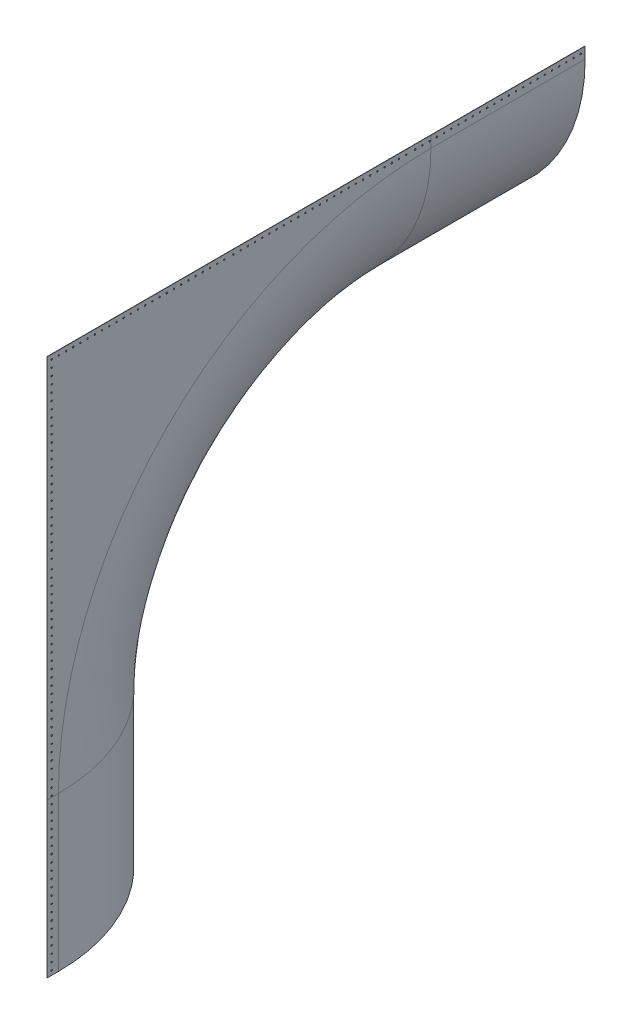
SolidWorks part; units mm, degrees
ref_plane "Front Plane" through (0, 0, 0) normal (1, 0, 0) x (0, 1, 0)
ref_plane "Top Plane" through (0, 0, 0) normal (0, 0, 1) x (0, 1, 0)
ref_plane "Right Plane" through (0, 0, 0) normal (0, 1, 0) x (-1, 0, 0)
sketch "sk 48.2in rad pnl" plane through (0, 0, 0) normal (0, 0, 1) x (0, 1, 0)
  line B0 (0, -1222.6925) -> (75.7466, -1222.6925)
  line B1 (-1222.6925, 75.7378) -> (-1222.6925, 0)
  line B2 (-1224.28, 75.7378) -> (-1224.28, 0)
  line B3 (-1224.28, 75.7378) -> (-1222.6925, 75.7378)
  line B4 (75.7466, -1222.6925) -> (75.7466, -1224.28)
  line B5 (0, -1224.28) -> (75.7466, -1224.28)
  arc B6 (0, -1224.28) -> (-1224.28, 0) centre (0, 0) cw
  arc B7 (0, -1222.6925) -> (-1222.6925, 0) centre (0, 0) cw
sketch_block_instance "48.2in rad pnl-1"
sketch_block "48.2in rad pnl" parameters "D1"=1224.28
sketch "Corner Arch" plane through (0, 0, 0) normal (1, 0, 0) x (0, 1, 0)
  line L0 (0, 75.7422) -> (0, 0)
  line L1 (-2498.8, 2574.5422) -> (-2574.5422, 2574.5422)
  arc A0 (-2498.8, 2574.5422) -> (0, 75.7422) centre (-2498.8, 75.7422) cw
  dimension "D3" = 2498.8
  dimension "D1" = 75.7422
  dimension "D2" = 75.7422
sweep "Sweep2" add profiles "sk 48.2in rad pnl" path "Corner Arch"
sketch "Lower profile" plane through (0, 0, 0) normal (0, 0, -1) x (1, 0, 0)
  line L0 (-75.7378, 1224.28) -> (0, 1224.28)
  line L1 (1224.28, -75.7466) -> (1224.28, 0)
  line L3 (1222.6925, -75.7466) -> (1222.6925, 0)
  line L4 (-75.7378, 1222.6925) -> (0, 1222.6925)
  line L5 (1222.6925, -75.7466) -> (1224.28, -75.7466)
  line L6 (-75.7378, 1224.28) -> (-75.7378, 1222.6925)
  line L7 (1224.28, 0) -> (1224.28, -75.7466) construction
  arc A0 (0, 1224.28) -> (1224.28, 0) centre (0, 0) cw
  arc A1 (1224.28, 0) -> (0, 1224.28) centre (0, 0) ccw construction
  arc A2 (0, 1222.6925) -> (1222.6925, 0) centre (0, 0) cw
  dimension "D1" = 1.5875
extrude "Boss-Extrude1" add sketch "Lower profile" along normal blind 1007.1378
sketch "Sketch9" plane through (1224.28, 0, 0) normal (1, 0, 0) x (0, 1, 0)
  line L0 (75.7466, 75.7422) -> (75.7466, 2650.2888)
  line L2 (-2498.8, 2650.2888) -> (75.7466, 2650.2888)
  arc A0 (-2498.8, 2650.2888) -> (75.7466, 75.7422) centre (-2498.8, 75.7422) cw
  arc A1 (75.7466, 75.7422) -> (-2498.8, 2650.2888) centre (-2498.8, 75.7422) ccw construction
extrude "Boss-Extrude2" add sketch "Sketch9" against normal blind 1.5875
sketch "Sketch10" plane through (-75.7378, 0, 0) normal (-1, 0, 0) x (0, -1, 0)
  line B0 (2574.5422, 1350.2622) -> (2498.8, 1350.2622)
  line B1 (1224.28, 75.7422) -> (1224.28, -920.7378)
  line B2 (2574.5422, 1351.8497) -> (2498.8, 1351.8497)
  line B3 (1222.6925, 75.7422) -> (1222.6925, -920.7378)
  line B4 (1222.6925, -920.7378) -> (1224.28, -920.7378)
  line B5 (2574.5422, 1351.8497) -> (2574.5422, 1350.2622)
  arc B6 (2498.8, 1350.2622) -> (1224.28, 75.7422) centre (2498.8, 75.7422) ccw
  arc B7 (2498.8, 1351.8497) -> (1222.6925, 75.7422) centre (2498.8, 75.7422) ccw
sketch_block_instance "Radi Intersect-1"
sketch_block "Radi Intersect"
sketch "Sketch12" plane through (0, -2574.5422, 0) normal (0, -1, 0) x (1, 0, 0)
  line L0 (1224.28, 2650.2888) -> (1224.28, 2574.5422)
  line L1 (0, 1350.2622) -> (-75.7378, 1350.2622)
  line L2 (1222.6925, 2650.2888) -> (1222.6925, 2574.5422)
  line L3 (0, 1351.8497) -> (-75.7378, 1351.8497)
  line L4 (-75.7378, 1351.8497) -> (-75.7378, 1350.2622)
  line L5 (1222.6925, 2650.2888) -> (1224.28, 2650.2888)
  arc A0 (1224.28, 2574.5422) -> (0, 1350.2622) centre (0, 2574.5422) cw
  arc A1 (0, 1350.2622) -> (1224.28, 2574.5422) centre (0, 2574.5422) ccw construction
  arc A2 (1222.6925, 2574.5422) -> (0, 1351.8497) centre (0, 2574.5422) cw
  dimension "D1" = 1.5875
extrude "Boss-Extrude3" add sketch "Sketch12" along normal blind 1006.96
sketch "Sketch11" plane through (1224.28, 0, 0) normal (1, 0, 0) x (0, 1, 0)
  line L3 (75.7466, 75.7422) -> (75.7466, 2650.2888) construction
  line L4 (75.7466, 2650.2888) -> (-2498.8, 2650.2888) construction
  circle A151 centre (45.2622, 1400.6044) radius 4.826
  circle A152 centre (45.2622, 1352.3444) radius 4.826
  circle A153 centre (45.2622, 1304.0844) radius 4.826
  circle A154 centre (45.2622, 1255.8244) radius 4.826
  circle A155 centre (45.2622, 1207.5644) radius 4.826
  circle A156 centre (45.2622, 1159.3044) radius 4.826
  circle A157 centre (45.2622, 1111.0444) radius 4.826
  circle A158 centre (45.2622, 1062.7844) radius 4.826
  circle A159 centre (45.2622, 1014.5244) radius 4.826
  circle A160 centre (45.2622, 966.2644) radius 4.826
  circle A161 centre (45.2622, 918.0044) radius 4.826
  circle A162 centre (45.2622, 869.7444) radius 4.826
  circle A163 centre (45.2622, 821.4844) radius 4.826
  circle A164 centre (45.2622, 773.2244) radius 4.826
  circle A165 centre (45.2622, 724.9644) radius 4.826
  circle A166 centre (45.2622, 676.7044) radius 4.826
  circle A167 centre (45.2622, 628.4444) radius 4.826
  circle A168 centre (45.2622, 580.1844) radius 4.826
  circle A169 centre (45.2622, 531.9244) radius 4.826
  circle A170 centre (45.2622, 483.6644) radius 4.826
  circle A171 centre (45.2622, 435.4044) radius 4.826
  circle A172 centre (45.2622, 387.1444) radius 4.826
  circle A173 centre (45.2622, 338.8844) radius 4.826
  circle A174 centre (45.2622, 290.6244) radius 4.826
  circle A175 centre (45.2622, 242.3644) radius 4.826
  circle A176 centre (-1173.9378, 2619.8044) radius 4.826
  circle A177 centre (-1222.1978, 2619.8044) radius 4.826
  circle A178 centre (-1270.4578, 2619.8044) radius 4.826
  circle A179 centre (-1318.7178, 2619.8044) radius 4.826
  circle A180 centre (-1366.9778, 2619.8044) radius 4.826
  circle A181 centre (-1415.2378, 2619.8044) radius 4.826
  circle A182 centre (-1463.4978, 2619.8044) radius 4.826
  circle A183 centre (-1511.7578, 2619.8044) radius 4.826
  circle A184 centre (-1560.0178, 2619.8044) radius 4.826
  circle A185 centre (-1608.2778, 2619.8044) radius 4.826
  circle A186 centre (-1656.5378, 2619.8044) radius 4.826
  circle A187 centre (-1704.7978, 2619.8044) radius 4.826
  circle A188 centre (-1753.0578, 2619.8044) radius 4.826
  circle A189 centre (-1801.3178, 2619.8044) radius 4.826
  circle A190 centre (-1849.5778, 2619.8044) radius 4.826
  circle A191 centre (-1897.8378, 2619.8044) radius 4.826
  circle A192 centre (-1946.0978, 2619.8044) radius 4.826
  circle A193 centre (-1994.3578, 2619.8044) radius 4.826
  circle A194 centre (-2042.6178, 2619.8044) radius 4.826
  circle A195 centre (-2090.8778, 2619.8044) radius 4.826
  circle A196 centre (-2139.1378, 2619.8044) radius 4.826
  circle A197 centre (-2187.3978, 2619.8044) radius 4.826
  circle A198 centre (-2235.6578, 2619.8044) radius 4.826
  circle A199 centre (-2283.9178, 2619.8044) radius 4.826
  circle A200 centre (-2332.1778, 2619.8044) radius 4.826
  circle A201 centre (-2393.1378, 2619.8044) radius 4.826
  circle A202 centre (-2441.3978, 2619.8044) radius 4.826
  circle A203 centre (-2489.6578, 2619.8044) radius 4.826
  circle A204 centre (-2537.9178, 2619.8044) radius 4.826
  circle A205 centre (-2586.1778, 2619.8044) radius 4.826
  circle A206 centre (-2634.4378, 2619.8044) radius 4.826
  circle A207 centre (-2682.6978, 2619.8044) radius 4.826
  circle A208 centre (-2730.9578, 2619.8044) radius 4.826
  circle A209 centre (-2779.2178, 2619.8044) radius 4.826
  circle A210 centre (-2827.4778, 2619.8044) radius 4.826
  circle A211 centre (-2875.7378, 2619.8044) radius 4.826
  circle A212 centre (-2923.9978, 2619.8044) radius 4.826
  circle A213 centre (-2972.2578, 2619.8044) radius 4.826
  circle A214 centre (-3020.5178, 2619.8044) radius 4.826
  circle A215 centre (-3068.7778, 2619.8044) radius 4.826
  circle A216 centre (-3117.0378, 2619.8044) radius 4.826
  circle A217 centre (-3165.2978, 2619.8044) radius 4.826
  circle A218 centre (-3213.5578, 2619.8044) radius 4.826
  circle A219 centre (-3261.8178, 2619.8044) radius 4.826
  circle A220 centre (-3310.0778, 2619.8044) radius 4.826
  circle A221 centre (-3358.3378, 2619.8044) radius 4.826
  circle A222 centre (-3406.5978, 2619.8044) radius 4.826
  circle A223 centre (-3454.8578, 2619.8044) radius 4.826
  circle A224 centre (-3503.1178, 2619.8044) radius 4.826
  circle A225 centre (-3551.3778, 2619.8044) radius 4.826
  circle A226 centre (45.2622, 181.4044) radius 4.826
  circle A227 centre (45.2622, 133.1444) radius 4.826
  circle A228 centre (45.2622, 84.8844) radius 4.826
  circle A229 centre (45.2622, 36.6244) radius 4.826
  circle A230 centre (45.2622, -11.6356) radius 4.826
  circle A231 centre (45.2622, -59.8956) radius 4.826
  circle A232 centre (45.2622, -108.1556) radius 4.826
  circle A233 centre (45.2622, -156.4156) radius 4.826
  circle A234 centre (45.2622, -204.6756) radius 4.826
  circle A235 centre (45.2622, -252.9356) radius 4.826
  circle A236 centre (45.2622, -301.1956) radius 4.826
  circle A237 centre (45.2622, -349.4556) radius 4.826
  circle A238 centre (45.2622, -397.7156) radius 4.826
  circle A239 centre (45.2622, -445.9756) radius 4.826
  circle A240 centre (45.2622, -494.2356) radius 4.826
  circle A241 centre (45.2622, -542.4956) radius 4.826
  circle A242 centre (45.2622, -590.7556) radius 4.826
  circle A243 centre (45.2622, -639.0156) radius 4.826
  circle A244 centre (45.2622, -687.2756) radius 4.826
  circle A245 centre (45.2622, -735.5356) radius 4.826
  circle A246 centre (45.2622, -783.7956) radius 4.826
  circle A247 centre (45.2622, -832.0556) radius 4.826
  circle A248 centre (45.2622, -880.3156) radius 4.826
  circle A249 centre (45.2622, -928.5756) radius 4.826
  circle A250 centre (45.2622, -976.8356) radius 4.826
  circle A262 centre (45.2622, 2619.8044) radius 4.826
  circle A263 centre (-2.9978, 2619.8044) radius 4.826
  circle A264 centre (-51.2578, 2619.8044) radius 4.826
  circle A265 centre (-99.5178, 2619.8044) radius 4.826
  circle A266 centre (-147.7778, 2619.8044) radius 4.826
  circle A267 centre (-196.0378, 2619.8044) radius 4.826
  circle A268 centre (-244.2978, 2619.8044) radius 4.826
  circle A269 centre (-292.5578, 2619.8044) radius 4.826
  circle A270 centre (-340.8178, 2619.8044) radius 4.826
  circle A271 centre (-389.0778, 2619.8044) radius 4.826
  circle A272 centre (-437.3378, 2619.8044) radius 4.826
  circle A273 centre (-485.5978, 2619.8044) radius 4.826
  circle A274 centre (-533.8578, 2619.8044) radius 4.826
  circle A275 centre (-582.1178, 2619.8044) radius 4.826
  circle A276 centre (-630.3778, 2619.8044) radius 4.826
  circle A277 centre (-678.6378, 2619.8044) radius 4.826
  circle A278 centre (-726.8978, 2619.8044) radius 4.826
  circle A279 centre (-775.1578, 2619.8044) radius 4.826
  circle A280 centre (-823.4178, 2619.8044) radius 4.826
  circle A281 centre (-871.6778, 2619.8044) radius 4.826
  circle A282 centre (-919.9378, 2619.8044) radius 4.826
  circle A283 centre (-968.1978, 2619.8044) radius 4.826
  circle A284 centre (-1016.4578, 2619.8044) radius 4.826
  circle A285 centre (-1064.7178, 2619.8044) radius 4.826
  circle A286 centre (-1112.9778, 2619.8044) radius 4.826
  circle A287 centre (45.2622, 2571.5444) radius 4.826
  circle A288 centre (45.2622, 2523.2844) radius 4.826
  circle A289 centre (45.2622, 2475.0244) radius 4.826
  circle A290 centre (45.2622, 2426.7644) radius 4.826
  circle A291 centre (45.2622, 2378.5044) radius 4.826
  circle A292 centre (45.2622, 2330.2444) radius 4.826
  circle A293 centre (45.2622, 2281.9844) radius 4.826
  circle A294 centre (45.2622, 2233.7244) radius 4.826
  circle A295 centre (45.2622, 2185.4644) radius 4.826
  circle A296 centre (45.2622, 2137.2044) radius 4.826
  circle A297 centre (45.2622, 2088.9444) radius 4.826
  circle A298 centre (45.2622, 2040.6844) radius 4.826
  circle A299 centre (45.2622, 1992.4244) radius 4.826
  circle A300 centre (45.2622, 1944.1644) radius 4.826
  circle A301 centre (45.2622, 1895.9044) radius 4.826
  circle A302 centre (45.2622, 1847.6444) radius 4.826
  circle A303 centre (45.2622, 1799.3844) radius 4.826
  circle A304 centre (45.2622, 1751.1244) radius 4.826
  circle A305 centre (45.2622, 1702.8644) radius 4.826
  circle A306 centre (45.2622, 1654.6044) radius 4.826
  circle A307 centre (45.2622, 1606.3444) radius 4.826
  circle A308 centre (45.2622, 1558.0844) radius 4.826
  circle A309 centre (45.2622, 1509.8244) radius 4.826
  circle A310 centre (45.2622, 1461.5644) radius 4.826
  dimension "D2" = 30.4844
  dimension "D6" = 2
  dimension "D9" = 60.96
  dimension "D12" = 2
  dimension "D15" = 25
  dimension "D1" = 9.652
  dimension "D11" = 25
  dimension "D3" = 30.4844
  dimension "D5" = 25
  dimension "D8" = 25
  dimension "D14" = 2
  dimension "D7" = 60.96
  dimension "D13" = 60.96
  dimension "D4" = 25
  dimension "D10" = 2
extrude "Cut-Extrude1" cut sketch "Sketch11" against normal blind 10
sketch "Sketch13" plane through (0, 0, 0) normal (1, 0, 0) x (0, 1, 0)
  line L1 (-4091.7296, 1838.796) -> (309.4003, 1838.796)
  line L2 (-4091.7296, 1838.796) -> (-4091.7296, -1107.3155)
  line L3 (-4091.7296, -1107.3155) -> (309.4003, -1107.3155)
  line L4 (309.4003, 1838.796) -> (309.4003, -1107.3155)
extrude "Cut-Extrude2" cut sketch "Sketch13" against normal through all
sketch "Sketch14" plane through (0, 0, 0) normal (1, 0, 0) x (0, 1, 0)
  line L0 (-3958.437, 2838.1493) -> (-3532.15, 2838.1493)
  line L1 (-3532.15, 2838.1493) -> (-3532.15, -957.7856)
  line L2 (-3532.15, -957.7856) -> (231.6155, -957.7856)
  line L3 (231.6155, -957.7856) -> (231.6155, -1221.4953)
  line L4 (231.6155, -1221.4953) -> (-3958.437, -1221.4953)
  line L5 (-3958.437, -1221.4953) -> (-3958.437, 2838.1493)
  line L6 (-3581.5022, 2574.5422) -> (-3581.5022, 1350.2622) construction
  line L7 (75.7466, -1007.1378) -> (0, -1007.1378) construction
  dimension "D1" = 49.3522
  dimension "D2" = 49.3522
extrude "Cut-Extrude3" cut sketch "Sketch14" along normal through all both and the other way through all
sketch "Sketch15" plane through (0, 0, 0) normal (1, 0, 0) x (0, 1, 0)
  line L0 (-2500.15, 2867.3945) -> (-2500.15, 74.3922)
  line L1 (-2500.15, 74.3922) -> (744.4396, 74.3922)
  line L2 (744.4396, 74.3922) -> (744.4396, 25.04)
  line L3 (744.4396, 25.04) -> (-2549.5022, 25.04)
  line L4 (-2549.5022, 25.04) -> (-2549.5022, 2867.3945)
  line L5 (-2549.5022, 2867.3945) -> (-2500.15, 2867.3945)
  line L6 (-2498.8, 2574.5422) -> (-2498.8, 2650.2888) construction
  line L7 (0, 75.7422) -> (75.7466, 75.7422) construction
  dimension "D1" = 1.35
  dimension "D2" = 1.35
  dimension "D3" = 49.3522
  dimension "D4" = 49.3522
extrude "Cut-Extrude4" [suppressed] cut sketch "Sketch15" along normal through all both and the other way through all
